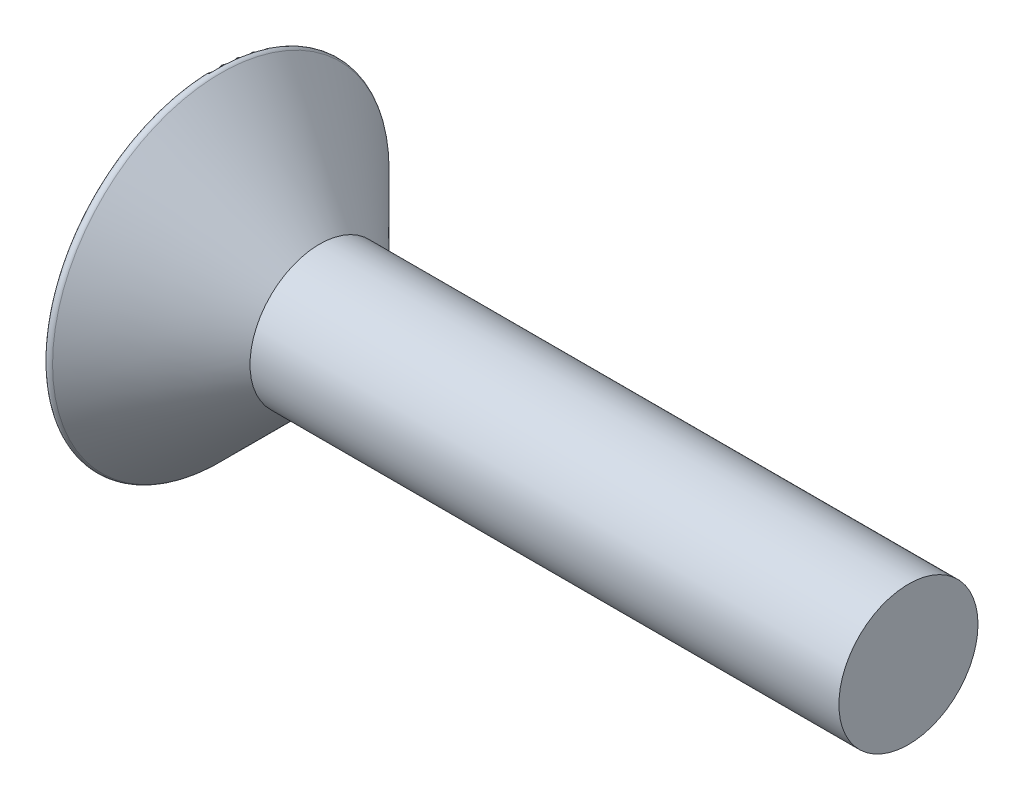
SolidWorks part; units mm, degrees
ref_plane "Front" through (0, 0, 0) normal (0, 0, 1) x (1, 0, 0)
ref_plane "Top" through (0, 0, 0) normal (0, 1, 0) x (1, 0, 0)
ref_plane "Right" through (0, 0, 0) normal (1, 0, 0) x (0, 0, -1)
ref_plane "Plane1" through (4.6, 0, 0) normal (1, 0, 0) x (0, 0, -1)
sketch "Sketch1" plane through (4.6, 0, 0) normal (1, 0, 0) x (0, 0, -1)
  circle A0 centre (0, 0) radius 3
extrude "BaseHead" add sketch "Sketch1" against normal blind 4.6 draft 45
sketch "Sketch2" plane through (4.6, 0, 0) normal (1, 0, 0) x (0, 0, -1)
  circle A1 centre (0, 0) radius 3
extrude "BaseBody" add sketch "Sketch2" along normal blind 30
sketch "Sketch7" plane through (0, 0, 0) normal (0, 0, 1) x (1, 0, 0)
  line L0 (30, 6) -> (30, -6)
  line L1 (34.6, -3) -> (34.6, 3) construction
  line L2 (34.6, 3) -> (4.6, 3) construction
  line L3 (4.6, -3) -> (34.6, -3) construction
  dimension "D1" = 4.6
  dimension "D2" = 3
  dimension "D3" = 3
extrude "Cut-Extrude3" cut sketch "Sketch7" against normal through all and the other way through all
sketch "Sketch8" plane through (0, 0, 0) normal (0, 0, 1) x (1, 0, 0)
  line L0 (0, 7.6) -> (4.6, 3)
  line L2 (6.3071, 2.7071) -> (6.6, 3)
  line L3 (6.6, 3) -> (6.6, 7.6)
  line L4 (6.6, 7.6) -> (0, 7.6)
  line L5 (30, 3) -> (4.6, 3) construction
  line L6 (0, 0) -> (8.9995, 0) construction
  line L7 (4.6, 3) -> (4.6, -3) construction
  arc A0 (4.6, 3) -> (6.3071, 2.7071) centre (5.6607, 4.0607) ccw
  dimension "r" = 1.5
  dimension "D1" = 45
  dimension "a" = 2
sketch "Sketch4" plane through (0, 0, 0) normal (1, 0, 0) x (0, 0, -1)
  line L1 (2.396, 0) -> (1.198, 2.075)
  line L2 (1.198, 2.075) -> (-1.198, 2.075)
  line L3 (-1.198, 2.075) -> (-2.396, 0)
  line L4 (-2.396, 0) -> (-1.198, -2.075)
  line L5 (-1.198, -2.075) -> (1.198, -2.075)
  line L6 (1.198, -2.075) -> (2.396, 0)
  circle A0 centre (0, 0) radius 2.075 construction
  dimension "B" = 4.15
extrude "Socket" cut sketch "Sketch4" along normal blind 2
sketch "Sketch5" plane through (2, 0, 0) normal (-1, 0, 0) x (0, 0, 1)
  line L0 (-1.198, 2.075) -> (1.198, 2.075) construction
  line L1 (1.198, 2.075) -> (2.396, 0) construction
  line L2 (2.396, 0) -> (1.198, -2.075) construction
  line L3 (1.198, -2.075) -> (-1.198, -2.075) construction
  line L4 (-2.396, 0) -> (-1.198, 2.075) construction
  line L5 (-1.198, -2.075) -> (-2.396, 0) construction
  line L6 (-1.198, 2.075) -> (1.198, 2.075)
  line L7 (1.198, 2.075) -> (2.396, 0)
  line L8 (2.396, 0) -> (1.198, -2.075)
  line L9 (1.198, -2.075) -> (-1.198, -2.075)
  line L10 (-2.396, 0) -> (-1.198, 2.075)
  line L11 (-1.198, -2.075) -> (-2.396, 0)
extrude "Cut-Extrude2" cut sketch "Sketch5" against normal blind 5 draft 60
sketch "Sketch6" plane through (-30.7487, 13.2487, 0) normal (0, 0, 1) x (0, -1, 0)
  line L0 (13.2487, 89.8637) -> (13.2487, 24.8312) construction
  line L1 (10.6609, 35.7609) -> (10.2487, 35.3487)
  line L2 (-7.1919, 35.3487) -> (-7.1919, 22.7487)
  line L3 (-7.1919, 22.7487) -> (10.2487, 22.7487)
  line L4 (10.7487, 35.973) -> (10.7487, 21.4009)
  line L5 (16.2487, 60.7487) -> (10.2487, 60.7487) construction
  line L6 (10.2487, 22.7487) -> (10.7487, 21.4009)
  line L8 (10.2487, 35.3487) -> (-7.1919, 35.3487)
  arc A0 (10.7487, 35.973) -> (10.6609, 35.7609) centre (10.4487, 35.973) cw
  dimension "D3" = 0.3
  dimension "d1" = 5
  dimension "b" = 38
  dimension "x" = 1.3478
fillet "HeadFillet" radius 0.2 1 edges at (0, 0, -7.6)
sketch "Sketch9" plane through (0, 0, 0) normal (0, 0, 1) x (1, 0, 0)
  line L0 (30, 2.567) -> (30.25, 3)
  line L1 (30.25, 3) -> (30.25, 3.5)
  line L2 (30.25, 3.5) -> (29.75, 3.5)
  line L3 (29.75, 3.5) -> (29.75, 3)
  line L4 (29.75, 3) -> (30, 2.567)
  line L5 (0, 0) -> (36.7555, 0) construction
  line L6 (30, -3) -> (30, 3) construction
  dimension "D1" = 6
  dimension "D2" = 0.5
revolve "Cut-Revolve10" [suppressed] cut sketch "Sketch9" angle 360 about L5
pattern_linear "LPattern10" [suppressed] count 39 spacing 0.6 along (1, 0, 0)
equation "\"D1@Plane1\" = \"k@BaseHead\""
equation "\"D1@Sketch7\" = \"k@BaseHead\""
equation "\"D1@Sketch9\" = \"d@Sketch2\""
equation "\"D2@Sketch9\" =  ( \"d@Sketch2\" - \"THD_MINOR@ThreadCosmetic1\" )  / 2"
equation "\"D3@LPattern10\" = \"D2@Sketch9\" * 1.2"
equation "\"D1@LPattern10\" = \"bb@ThreadCosmetic1\" / \"D3@LPattern10\" "
